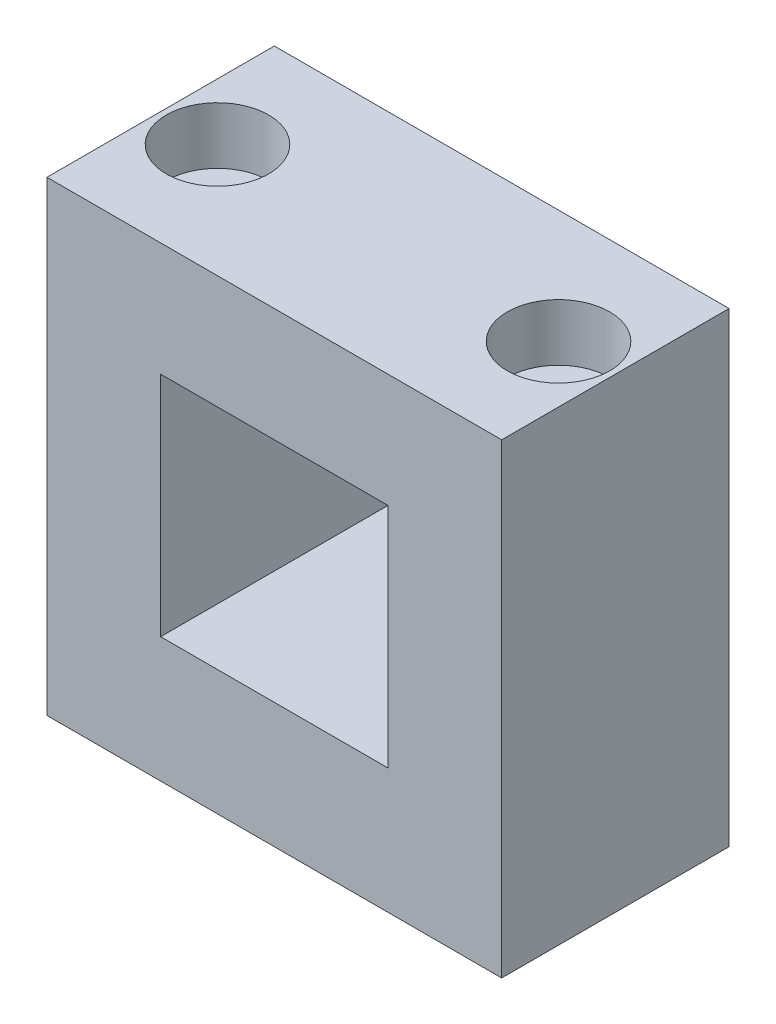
SolidWorks part; units mm, degrees
ref_plane "Front Plane" through (0, 0, 0) normal (0, 0, 1) x (1, 0, 0)
ref_plane "Top Plane" through (0, 0, 0) normal (0, 1, 0) x (1, 0, 0)
ref_plane "Right Plane" through (0, 0, 0) normal (1, 0, 0) x (0, 0, -1)
sketch "Sketch1" plane through (0, 0, 0) normal (0, 0, 1) x (1, 0, 0)
  line L0 (0, 26.035) -> (0, 0) construction
  line L6 (-12.7, 13.335) -> (12.7, 13.335)
  line L7 (-25.4, -26.035) -> (25.4, -26.035)
  line L8 (-25.4, -26.035) -> (-25.4, 26.035)
  line L9 (-25.4, 26.035) -> (25.4, 26.035)
  line L10 (25.4, -26.035) -> (25.4, 26.035)
  line L11 (-25.4, -26.035) -> (25.4, 26.035) construction
  line L12 (-25.4, 26.035) -> (25.4, -26.035) construction
  line L13 (-12.7, 13.335) -> (-12.7, -12.065)
  line L14 (-12.7, -12.065) -> (12.7, -12.065)
  line L15 (12.7, 13.335) -> (12.7, -12.065)
  line L16 (-12.7, 13.335) -> (12.7, -12.065) construction
  line L17 (-12.7, -12.065) -> (12.7, 13.335) construction
  point P0 (0, 0)
  point P3 (0, 0.635)
  point P6 (0, 0)
extrude "Boss-Extrude1" add sketch "Sketch1" along normal mid plane 25.4
sketch "Sketch2" plane through (0, 26.035, 0) normal (0, 1, 0) x (1, 0, 0)
  line L0 (12.7, 12.7) -> (12.7, -12.7) construction
  line L1 (12.7, 0) -> (25.4, 0) construction
  line L2 (25.4, -12.7) -> (25.4, 12.7) construction
  line L3 (-19.05, 0) -> (19.05, 0) construction
  circle A0 centre (-19.05, 0) radius 3.175
  circle A1 centre (19.05, 0) radius 3.175
  point P6 (0, 0)
  dimension "D1" = 6.35
extrude "Cut-Extrude1" cut sketch "Sketch2" against normal up to surface (52.07 mm away)
sketch "Sketch3" plane through (0, 26.035, 0) normal (0, 1, 0) x (1, 0, 0)
  circle A0 centre (-19.05, 0) radius 5.715
  circle A1 centre (19.05, 0) radius 5.715
  dimension "D1" = 11.43
extrude "Cut-Extrude2" cut sketch "Sketch3" against normal blind 6.35
equation "\"D4@Sketch1\"=2.3-.25"
